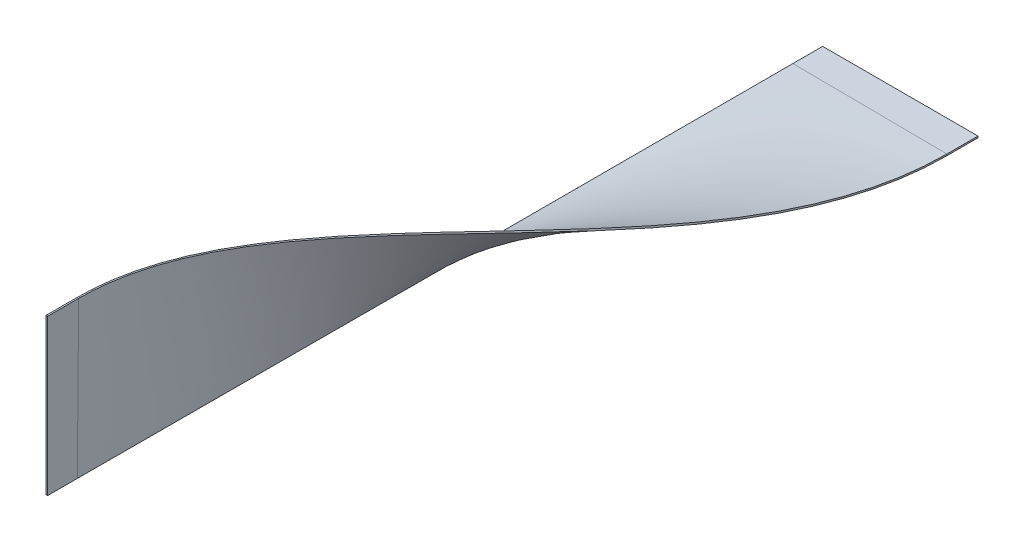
SolidWorks part; units mm, degrees
ref_plane "Ebene vorne" through (0, 0, 0) normal (0, 0, 1) x (1, 0, 0)
ref_plane "Ebene oben" through (0, 0, 0) normal (0, 1, 0) x (1, 0, 0)
ref_plane "Ebene rechts" through (0, 0, 0) normal (1, 0, 0) x (0, 0, -1)
sketch "Skizze1" plane through (0, 0, 0) normal (0, 1, 0) x (0, 0, -1)
  line L0 (0, 0) -> (-500, 0)
  dimension "D1" = 500
sheet metal parameters "Blech1" thickness 1 parameters "D1"=1.5, "Dicke"=1
sketch3d "3D-Skizze1"
  line L0 (0, 100, 500) -> (0, 100, 480)
  line L1 (100, 0, 20) -> (100, 0, 0)
  line L2 (0, 0, 0) -> (0, 0, 500) construction
  spline S0 degree 3 poles (0, 100, 480) (0, 100, 341.7169) (100, 0, 173.9607) (100, 0, 20) knots 0 0 0 0 1 1 1 1
  dimension "D1" = 100
  dimension "D2" = 20
  dimension "D3" = 100
  dimension "D4" = 20
lofted bend "Ausgeformte Biegungen1" parameters "D1"=0, "D12"=1
other "Freiform-Biegung1" parameters "D1"=1000, "D4"=57.296, "D5"=1
flat pattern "Abwicklung1"
sketch "Biegung-Linien1" plane through (0, 0, 0) normal (0, 1, 0) x (-1, 0, 0)
other "Abwickeln-<Freiform-Biegung1>1"
